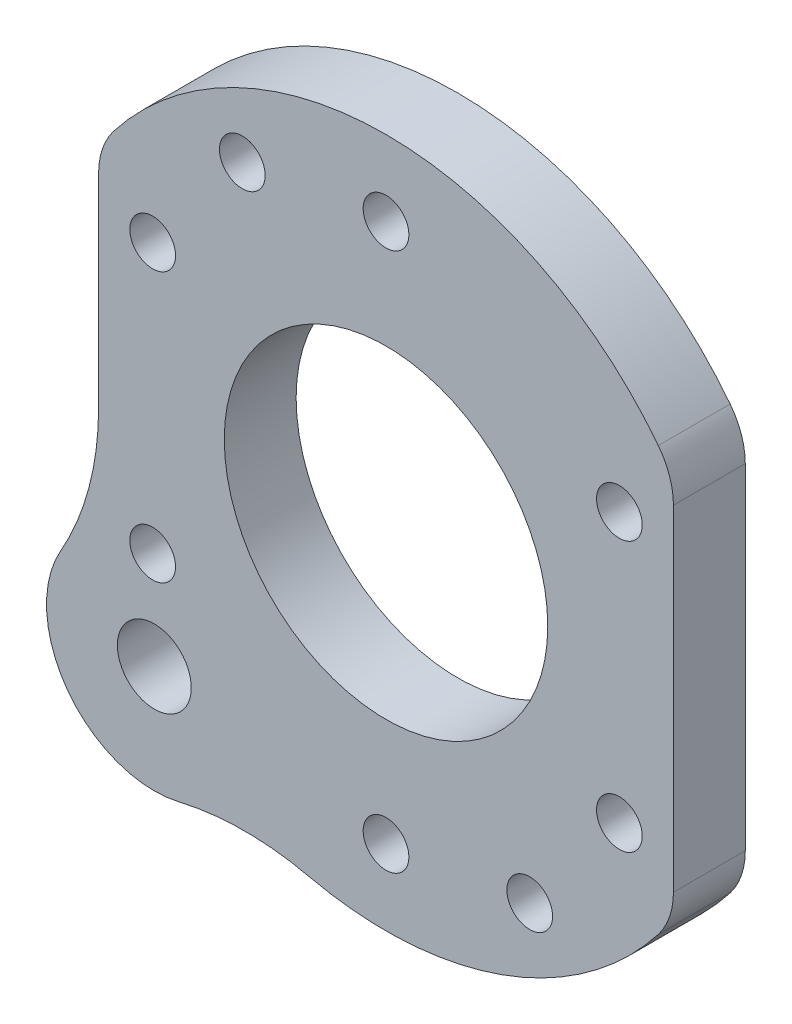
SolidWorks part; units mm, degrees
ref_plane "Front" through (0, 0, 0) normal (0, 0, 1) x (1, 0, 0)
ref_plane "Top" through (0, 0, 0) normal (0, 1, 0) x (1, 0, 0)
ref_plane "Right" through (0, 0, 0) normal (1, 0, 0) x (0, 0, -1)
sketch "Sketch1" plane through (0, 0, 0) normal (0, 0, 1) x (1, 0, 0)
  line L0 (-25.4, 16.8485) -> (-25.4, -16.8485)
  line L1 (-7.3323, 0) -> (-3.6662, -6.35)
  line L2 (-3.6662, -6.35) -> (3.6662, -6.35)
  line L3 (3.6662, -6.35) -> (7.3323, 0)
  line L4 (7.3323, 0) -> (3.6662, 6.35)
  line L5 (3.6662, 6.35) -> (-3.6662, 6.35)
  line L6 (-3.6662, 6.35) -> (-7.3323, 0)
  line L7 (25.4, 16.8485) -> (25.4, -16.8485)
  circle A0 centre (0, 0) radius 6.35 construction
  circle A1 centre (0, 0) radius 30.48
  circle A2 centre (0, 0) radius 23.8125 construction
  dimension "D2" = 60.96
  dimension "D3" = 47.625
  dimension "D1" = 12.7
  dimension "D4" = 25.4
  dimension "D5" = 25.4
extrude "Boss-Extrude1" add sketch "Sketch1" along normal blind 6.35 contours L7 A1 L0 L6 L5 L4 L3 L2 L1
hole_wizard "Tap Drill for #10-32 Tap3" positions "3DSketch2" profile "Sketch4" hole size "#10-32" standard "ANSI Inch"
sketch3d "3DSketch2"
  line L0 (0, 23.8125, 6.35) -> (0, 0, 6.35) construction
  point P0 (0, 23.8125, 6.35)
  point P3 (0, 23.8125, 6.35)
  point P17 (0, 23.8125, 6.35)
  dimension "D1" = 23.8125
sketch "Sketch4" plane through (0, 23.8125, 6.35) normal (1, 0, 0) x (0, -1, 0)
  line L0 (0, 0) -> (0, 6.35)
  line L1 (0, 6.35) -> (2.0193, 6.35)
  line L2 (2.0193, 6.35) -> (2.0193, 0)
  line L5 (2.0193, 0) -> (0, 0)
  line L11 (0, -6.35) -> (0, 107.95) construction
  dimension "Thru Hole Dia." = 4.0386
  dimension "Thru Hole Depth" = 6.35
pattern_circular "CirPattern1" count 6 over 360 about axis through (0, 0, 0) along (0, 0, 1) of "Tap Drill for #10-32 Tap3"
fillet "Fillet1" radius 6.35 4 edges at (25.4, 16.8485, 3.175) (25.4, -16.8485, 3.175) (-25.4, -16.8485, 3.175) (-25.4, 16.8485, 3.175)
sketch "Sketch5" plane through (0, 0, 0) normal (0, 0, -1) x (-1, 0, 0)
  line L1 (0, 0) -> (20.475, -20.475) construction
  line L2 (-3.6662, 6.35) -> (3.6662, 6.35) construction
  dimension "D2" = 45
  dimension "D3" = 28.956
sketch "Sketch6" plane through (0, 0, 0) normal (0, 0, -1) x (-1, 0, 0)
  line L2 (-25.4, 14.8106) -> (-25.4, -14.8106)
  line L3 (25.4, -14.8106) -> (25.4, 14.8106)
  line L4 (-25.4, 14.8106) -> (-25.4, -14.8106)
  line L5 (25.4, -14.8106) -> (25.4, 14.8106)
  circle A0 centre (20.475, -20.475) radius 9.525
  arc A7 (24.0632, 18.7081) -> (-24.0632, 18.7081) centre (0, 0) ccw
  arc A8 (-24.0632, 18.7081) -> (-25.4, 14.8106) centre (-19.05, 14.8106) ccw
  arc A9 (-25.4, -14.8106) -> (-24.0632, -18.7081) centre (-19.05, -14.8106) ccw
  arc A10 (-24.0632, -18.7081) -> (24.0632, -18.7081) centre (0, 0) ccw
  arc A11 (24.0632, -18.7081) -> (25.4, -14.8106) centre (19.05, -14.8106) ccw
  arc A12 (25.4, 14.8106) -> (24.0632, 18.7081) centre (19.05, 14.8106) ccw
  arc A13 (24.0632, 18.7081) -> (-24.0632, 18.7081) centre (0, 0) ccw
  arc A14 (-24.0632, 18.7081) -> (-25.4, 14.8106) centre (-19.05, 14.8106) ccw
  arc A15 (-25.4, -14.8106) -> (-24.0632, -18.7081) centre (-19.05, -14.8106) ccw
  arc A16 (-24.0632, -18.7081) -> (24.0632, -18.7081) centre (0, 0) ccw
  arc A17 (24.0632, -18.7081) -> (25.4, -14.8106) centre (19.05, -14.8106) ccw
  arc A18 (25.4, 14.8106) -> (24.0632, 18.7081) centre (19.05, 14.8106) ccw
  dimension "D1" = 19.05
  dimension "D2" = 0
extrude "Boss-Extrude2" add sketch "Sketch6" against normal up to vertex (6.35 mm away) contours A0 M17 M19 M18
hole_wizard "5/16-18 Tapped Hole1" positions "Sketch8" profile "Sketch7" tap size "5/16-18" standard "ANSI Inch"
sketch "Sketch8" plane through (0, 0, 0) normal (0, 0, -1) x (-1, 0, 0)
  point P0 (20.475, -20.475)
sketch "Sketch7" plane through (-20.475, -20.475, 0) normal (1, 0, 0) x (0, 1, 0)
  line L0 (0, 0) -> (0, 6.35)
  line L1 (0, 6.35) -> (3.2639, 6.35)
  line L2 (3.2639, 6.35) -> (3.2639, 0)
  line L5 (3.2639, 0) -> (0, 0)
  line L11 (0, -6.35) -> (0, 107.95) construction
  dimension "Thru Tap Drill Dia." = 6.5278
  dimension "Thru Tap Drill Depth" = 6.35
fillet "Fillet2" radius 25.4 2 edges at (-13.738, -27.2084, 3.175) (-25.4, -12.3221, 3.175)
sketch "Sketch9" plane through (0, 0, 6.35) normal (0, 0, 1) x (1, 0, 0)
  line L0 (-12.7, 21.997) -> (12.7, -21.997) construction
  line L1 (20.6222, -11.9063) -> (0, -23.8125) construction
  circle A0 centre (-12.7, 21.997) radius 2.3813
  circle A1 centre (12.7, -21.997) radius 2.3813
  point P2 (0, 0)
  point P6 (20.6222, -11.9063)
  point P7 (0, -23.8125)
  dimension "D1" = 4.7625
  dimension "D2" = 50.8
sketch "Sketch10" plane through (0, 0, 6.35) normal (0, 0, 1) x (1, 0, 0)
  circle A0 centre (0, 0) radius 14.2938
  dimension "D1" = 28.5877
extrude "Cut-Extrude2" cut sketch "Sketch10" against normal blind 6.35
hole_wizard "#10-32 Tapped Hole1" positions "3DSketch3" profile "Sketch11" tap size "#10-32" standard "ANSI Inch"
sketch3d "3DSketch3"
  point P0 (-12.7, 21.997, 6.35)
  point P3 (12.7, -21.997, 6.35)
sketch "Sketch11" plane through (-12.7, 21.997, 6.35) normal (1, 0, 0) x (0, -1, 0)
  line L0 (0, 0) -> (0, 6.35)
  line L1 (0, 6.35) -> (2.0193, 6.35)
  line L2 (2.0193, 6.35) -> (2.0193, 0)
  line L5 (2.0193, 0) -> (0, 0)
  line L11 (0, -6.35) -> (0, 107.95) construction
  dimension "Thru Tap Drill Dia." = 4.0386
  dimension "Thru Tap Drill Depth" = 6.35
